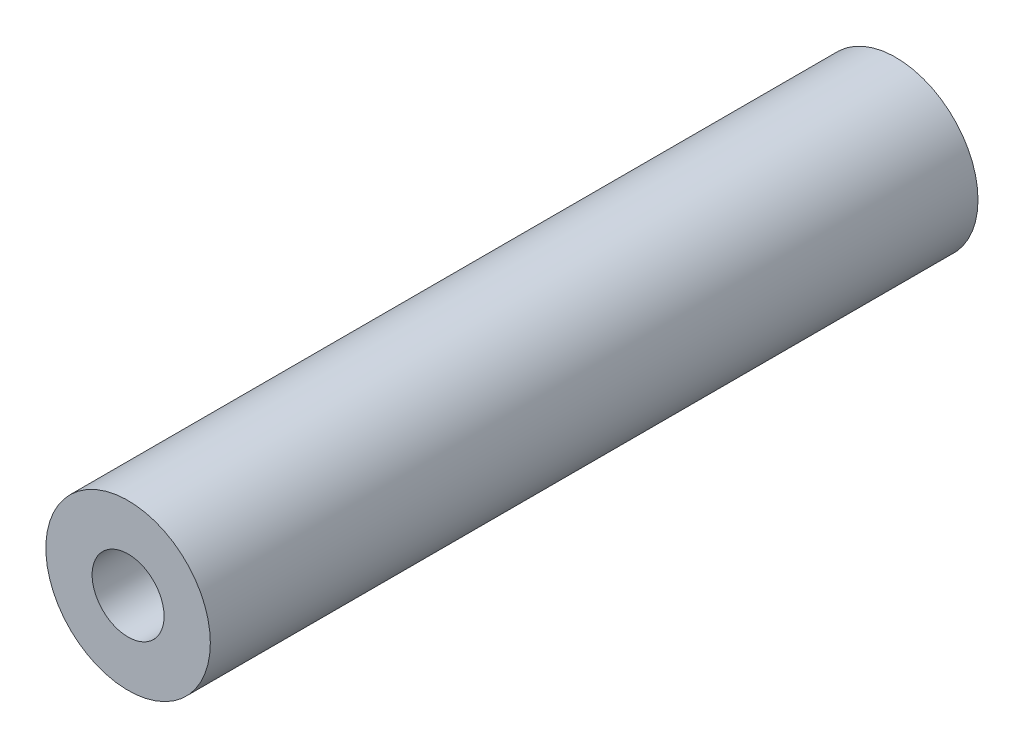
SolidWorks part; units mm, degrees
ref_plane "Front Plane" through (0, 0, 0) normal (0, 0, 1) x (1, 0, 0)
ref_plane "Top Plane" through (0, 0, 0) normal (0, 1, 0) x (1, 0, 0)
ref_plane "Right Plane" through (0, 0, 0) normal (1, 0, 0) x (0, 0, -1)
sketch "Sketch1" plane through (0, 0, 0) normal (0, 0, 1) x (1, 0, 0)
  circle A0 centre (0, 0) radius 4.7625
  circle A1 centre (0, 0) radius 1.778
  dimension "OD" = 9.525
  dimension "ID" = 3.556
extrude "Extrude1" add sketch "Sketch1" along normal mid plane 44.45
sketch "Sketch2" plane through (0, 0, 0) normal (1, 0, 0) x (0, 0, -1)
  line L0 (-22.225, -1.778) -> (22.225, -1.778) construction
  line L3 (22.225, 1.778) -> (-22.225, 1.778) construction
  line L5 (-22.225, -1.778) -> (22.225, -1.778)
  line L6 (22.225, 1.778) -> (-22.225, 1.778)
sketch "Sketch4" plane through (0, 0, 22.225) normal (0, 0, 1) x (1, 0, 0)
  line L0 (0, 0) -> (-1.2572, 1.2572)
  line L1 (0, -5.2388) -> (0, 5.2388) construction
  circle A0 centre (0, 0) radius 1.778 construction
  dimension "D1" = 45
hole_wizard "#8-32 Tapped Hole6" positions "Sketch5" profile "Sketch7" tap size "#8-32" standard "ANSI Inch"
sketch "Sketch5" plane through (0, 0, 22.225) normal (0, 0, 1) x (1, 0, 0)
  point P13 (0, 0)
sketch "Sketch7" plane through (0, 0, 22.225) normal (1, 0, 0) x (0, -1, 0)
  line L0 (0, 0) -> (0, 17.7002)
  line L1 (0, 17.7002) -> (1.7272, 16.6624)
  line L2 (1.7272, 16.6624) -> (1.7272, 12.7)
  line L3 (1.7272, 12.7) -> (2.0828, 12.7)
  line L4 (2.0828, 12.7) -> (2.0828, 0)
  line L5 (2.0828, 0) -> (0, 0)
  line L10 (0, 17.7002) -> (-1.7272, 16.6624) construction
  line L11 (0, -6.35) -> (0, 107.95) construction
  dimension "Tap Drill Dia." = 3.4544
  dimension "Tap Drill Depth" = 16.6624
  dimension "Thread Major Dia." = 4.1656
  dimension "Thread Depth" = 12.7
  dimension "Drill Angle" = 118
hole_wizard "#8-32 Tapped Hole7" positions "Sketch8" profile "Sketch9" tap size "#8-32" standard "ANSI Inch"
sketch "Sketch8" plane through (0, 0, -22.225) normal (0, 0, -1) x (-1, 0, 0)
  point P0 (0, 0)
sketch "Sketch9" plane through (0, 0, -22.225) normal (1, 0, 0) x (0, 1, 0)
  line L0 (0, 0) -> (0, 17.7002)
  line L1 (0, 17.7002) -> (1.7272, 16.6624)
  line L2 (1.7272, 16.6624) -> (1.7272, 12.7)
  line L3 (1.7272, 12.7) -> (2.0828, 12.7)
  line L4 (2.0828, 12.7) -> (2.0828, 0)
  line L5 (2.0828, 0) -> (0, 0)
  line L10 (0, 17.7002) -> (-1.7272, 16.6624) construction
  line L11 (0, -6.35) -> (0, 107.95) construction
  dimension "Tap Drill Dia." = 3.4544
  dimension "Tap Drill Depth" = 16.6624
  dimension "Thread Major Dia." = 4.1656
  dimension "Thread Depth" = 12.7
  dimension "Drill Angle" = 118
